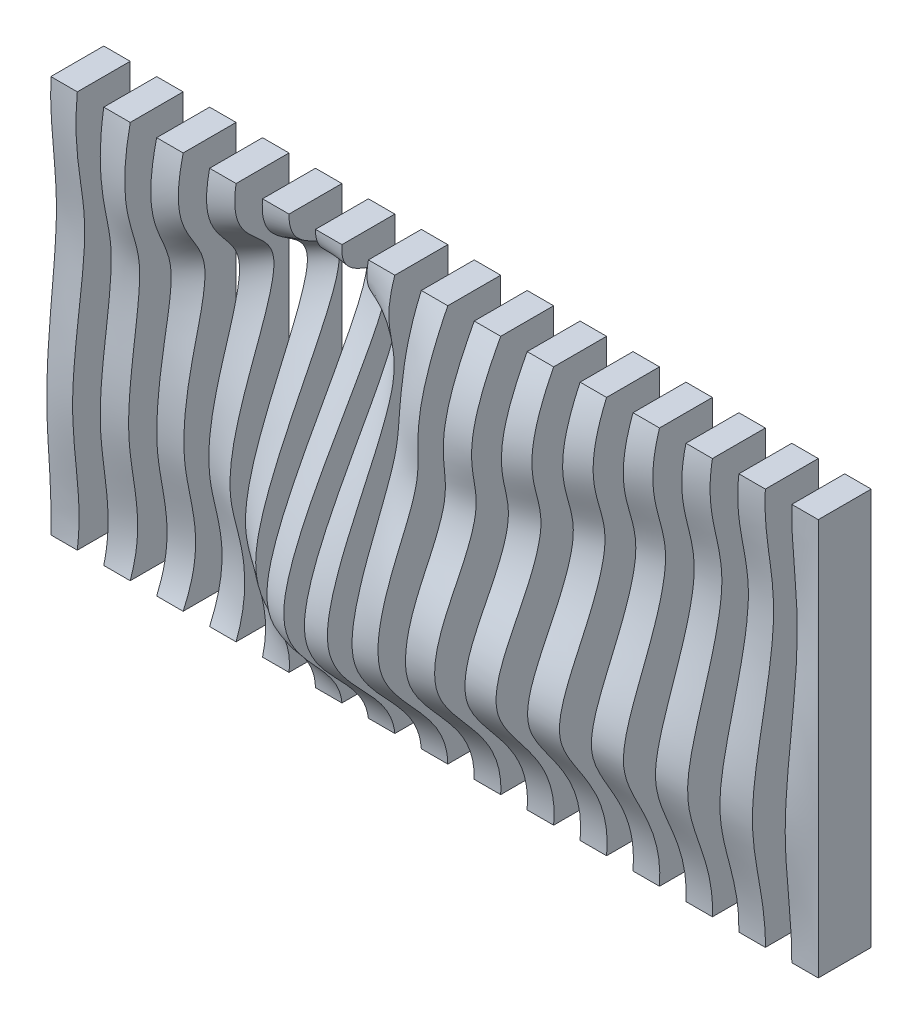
SolidWorks part; units mm, degrees
ref_plane "Ebene vorne" through (0, 0, 0) normal (0, 0, 1) x (1, 0, 0)
ref_plane "Ebene oben" through (0, 0, 0) normal (0, 1, 0) x (1, 0, 0)
ref_plane "Ebene rechts" through (0, 0, 0) normal (1, 0, 0) x (0, 0, -1)
ref_plane "Ebene1" through (0, 0, 100) normal (0, 0, 1) x (1, 0, 0)
sketch "Skizze1" plane through (0, 0, 100) normal (0, 0, 1) x (1, 0, 0)
  line L1 (-750, -375) -> (750, -375)
  line L2 (-750, -375) -> (-750, 375)
  line L3 (-750, 375) -> (750, 375)
  line L4 (750, -375) -> (750, 375)
  line L5 (-750, -375) -> (750, 375) construction
  line L6 (-750, 375) -> (750, -375) construction
  point P0 (0, 0)
  dimension "D1" = 1500
  dimension "D2" = 750
surface "Oberfläche-Ebene1" sketch "Skizze1"
other "Freiform1"
sketch "Skizze2" plane through (0, 0, 0) normal (0, 0, 1) x (1, 0, 0)
  line L1 (-750, -375) -> (750, -375)
  line L2 (-750, -375) -> (-750, 375)
  line L3 (-750, 375) -> (750, 375)
  line L4 (750, -375) -> (750, 375)
  line L5 (-750, -375) -> (750, 375) construction
  line L6 (-750, 375) -> (750, -375) construction
  point P0 (0, 0)
extrude "Aufsatz-Linear austragen1" add sketch "Skizze2" along normal up to surface (100 mm away)
sketch "Skizze3" plane through (0, 0, 0) normal (0, 0, 1) x (1, 0, 0)
  line L0 (750, 375) -> (-750, 375) construction
  line L1 (700, 375) -> (650, 375)
  line L2 (700, 375) -> (700, -375)
  line L3 (700, -375) -> (650, -375)
  line L4 (650, 375) -> (650, -375)
  line L5 (-750, -375) -> (750, -375) construction
  line L6 (750, -375) -> (750, 375) construction
  line L7 (600, 375) -> (600, -375)
  line L8 (550, 375) -> (550, -375)
  line L9 (600, -375) -> (550, -375)
  line L10 (600, 375) -> (550, 375)
  line L11 (500, 375) -> (500, -375)
  line L12 (450, 375) -> (450, -375)
  line L13 (500, -375) -> (450, -375)
  line L14 (500, 375) -> (450, 375)
  line L15 (400, 375) -> (400, -375)
  line L16 (350, 375) -> (350, -375)
  line L17 (400, -375) -> (350, -375)
  line L18 (400, 375) -> (350, 375)
  line L19 (300, 375) -> (300, -375)
  line L20 (250, 375) -> (250, -375)
  line L21 (300, -375) -> (250, -375)
  line L22 (300, 375) -> (250, 375)
  line L23 (200, 375) -> (200, -375)
  line L24 (150, 375) -> (150, -375)
  line L25 (200, -375) -> (150, -375)
  line L26 (200, 375) -> (150, 375)
  line L27 (100, 375) -> (100, -375)
  line L28 (50, 375) -> (50, -375)
  line L29 (100, -375) -> (50, -375)
  line L30 (100, 375) -> (50, 375)
  line L31 (0, 375) -> (0, -375)
  line L32 (-50, 375) -> (-50, -375)
  line L33 (0, -375) -> (-50, -375)
  line L34 (0, 375) -> (-50, 375)
  line L35 (-100, 375) -> (-100, -375)
  line L36 (-150, 375) -> (-150, -375)
  line L37 (-100, -375) -> (-150, -375)
  line L38 (-100, 375) -> (-150, 375)
  line L39 (-200, 375) -> (-200, -375)
  line L40 (-250, 375) -> (-250, -375)
  line L41 (-200, -375) -> (-250, -375)
  line L42 (-200, 375) -> (-250, 375)
  line L43 (-300, 375) -> (-300, -375)
  line L44 (-350, 375) -> (-350, -375)
  line L45 (-300, -375) -> (-350, -375)
  line L46 (-300, 375) -> (-350, 375)
  line L47 (-400, 375) -> (-400, -375)
  line L48 (-450, 375) -> (-450, -375)
  line L49 (-400, -375) -> (-450, -375)
  line L50 (-400, 375) -> (-450, 375)
  line L51 (-500, 375) -> (-500, -375)
  line L52 (-550, 375) -> (-550, -375)
  line L53 (-500, -375) -> (-550, -375)
  line L54 (-500, 375) -> (-550, 375)
  line L55 (-600, 375) -> (-600, -375)
  line L56 (-650, 375) -> (-650, -375)
  line L57 (-600, -375) -> (-650, -375)
  line L58 (-600, 375) -> (-650, 375)
  line L59 (-700, 375) -> (-700, -375)
  line L60 (-750, 375) -> (-750, -375)
  line L61 (-700, -375) -> (-750, -375)
  line L62 (-700, 375) -> (-750, 375)
  dimension "D1" = 50
  dimension "D2" = 50
  dimension "D3" = 15
extrude "Schnitt-Linear austragen1" cut sketch "Skizze3" along normal through all
split "Abspalten3" bodies to split 116 resulting bodies 160 161 162 163 164 165 166 167 168 169 170 171 172 173 174
